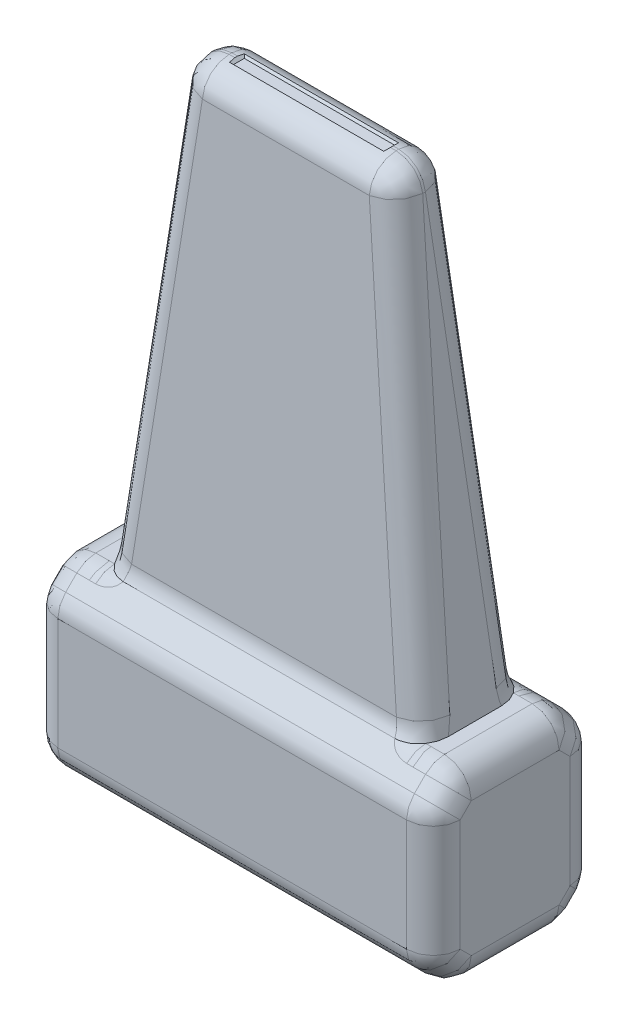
SolidWorks part; units mm, degrees
ref_plane "Спереди" through (0, 0, 0) normal (0, 0, 1) x (1, 0, 0)
ref_plane "Сверху" through (0, 0, 0) normal (0, 1, 0) x (1, 0, 0)
ref_plane "Справа" through (0, 0, 0) normal (1, 0, 0) x (0, 0, -1)
sketch "Эскиз1" plane through (0, 0, 0) normal (0, 0, 1) x (1, 0, 0)
  line L0 (0, 27.5659) -> (0, -13.9827) construction
  line L1 (-37.5, 0) -> (37.5, 0)
  line L2 (-37.5, 0) -> (-37.5, 35)
  line L3 (-37.5, 35) -> (37.5, 35)
  line L4 (37.5, 0) -> (37.5, 35)
  dimension "D1" = 35
  dimension "D2" = 75
extrude "Вытянуть1" add sketch "Эскиз1" along normal mid plane 30.5
sketch "Эскиз2" plane through (0, 0, 0) normal (0, 0, 1) x (1, 0, 0)
  line L0 (0, -8.0291) -> (0, 87.4697) construction
  line L1 (-30, 35) -> (-20, 120)
  line L2 (-20, 120) -> (20, 120)
  line L3 (20, 120) -> (30, 35)
  line L4 (30, 35) -> (-30, 35)
  line L5 (37.5, 35) -> (-37.5, 35) construction
  line L6 (-37.5, 0) -> (37.5, 0) construction
  dimension "D1" = 120
  dimension "D2" = 40
extrude "Вытянуть2" add sketch "Эскиз2" along normal mid plane 10
draft "Уклон1" type of draft neutral plane draft angle 3 faces to draft 2 parameters "D1"=3
sketch "Эскиз3" plane through (0, 0, 0) normal (0, -1, 0) x (1, 0, 0)
  line L0 (48.5885, 0) -> (-48.5885, 0) construction
  line L1 (0, -20.7863) -> (0, 26.1746) construction
  line L3 (30, 5.5) -> (-30, 5.5)
  line L4 (30, 5.5) -> (30, -5.5)
  line L5 (30, -5.5) -> (-30, -5.5)
  line L6 (-30, 5.5) -> (-30, -5.5)
  dimension "D1" = 60
  dimension "D2" = 11
extrude "Вырез-Вытянуть1" cut sketch "Эскиз3" against normal blind 19
draft "Уклон2" type of draft neutral plane draft angle 1 faces to draft 4 parameters "D1"=1
chamfer "Фаска1" distance 5 angle 45 4 edges at (0, 0, 15.25) (0, 0, -15.25) (0, 35, 15.25) (0, 35, -15.25)
fillet "Скругление2" radius 5 6 edges at (0, 30, 15.25) (0, 30, -15.25) (0, 5, 15.25) (0, 5, -15.25) (0, 0, -10.25) (0, 0, 10.25)
fillet "Скругление3" radius 5 28 edges at (37.5, 33.2322, -12.0178) (37.5, 29.8423, -14.8694) (37.5, 17.5, -15.25) (37.5, 5.1577, -14.8694) (37.5, 2.5, -12.75) (37.5, 0.3806, -10.0923) (37.5, 0, 0) (37.5, 0.3806, 10.0923) (37.5, 2.5, 12.75) (37.5, 5.1577, 14.8694) (37.5, 33.2322, 12.0178) (37.5, 29.8423, 14.8694) (37.5, 17.5, 15.25) (-37.5, 33.2322, 12.0178) (-37.5, 29.8423, 14.8694) (-37.5, 33.2322, -12.0178) (-37.5, 29.8423, -14.8694) (-37.5, 17.5, -15.25) (-37.5, 5.1577, -14.8694) (-37.5, 2.5, -12.75) (-37.5, 0.3806, -10.0923) (-37.5, 0, 0) (-37.5, 0.3806, 10.0923) (-37.5, 2.5, 12.75) (-37.5, 5.1577, 14.8694) (-37.5, 35, 0) (37.5, 35, 0) (-37.5, 17.5, 15.25)
fillet "Скругление4" radius 5 2 edges at (0, 35, -9.4547) (0, 35, 9.4547)
fillet "Скругление5" radius 5 8 edges at (-31.25, 35, -10.25) (-31.25, 35, 10.25) (31.25, 35, -10.25) (31.25, 35, 10.25) (-36.0355, 33.5355, -9.6434) (-36.0355, 33.5355, 9.6434) (36.0355, 33.5355, -9.6434) (36.0355, 33.5355, 9.6434)
fillet "Скругление6" radius 5 12 edges at (-29.8515, 36.2622, -9.5915) (29.8515, 36.2622, -9.5915) (29.8515, 36.2622, 9.5915) (-29.8515, 36.2622, 9.5915) (-20, 120, 0) (20, 120, 0) (0, 120, 5) (0, 120, -5) (-24.8436, 78.8294, -7.1577) (24.8436, 78.8294, -7.1577) (24.8436, 78.8294, 7.1577) (-24.8436, 78.8294, 7.1577)
fillet "Скругление7" radius 5 4 edges at (27.6545, 35, -10.25) (27.6545, 35, 10.25) (-27.6545, 35, -10.25) (-27.6545, 35, 10.25)
fillet "Скругление11" radius 2 8 edges at (-29.6684, 19, 0) (0, 19, 5.1684) (29.6684, 19, 0) (0, 19, -5.1684) (29.8342, 9.5, -5.3342) (-29.8342, 9.5, -5.3342) (-29.8342, 9.5, 5.3342) (29.8342, 9.5, 5.3342)
sketch "Эскиз4" plane through (0, 120, 0) normal (0, 1, 0) x (-1, 0, 0)
  line L0 (0, -4.1383) -> (0, 4.7977) construction
  line L1 (14.5, -1.5) -> (-14.5, -1.5)
  line L2 (14.5, -1.5) -> (14.5, 1.5)
  line L3 (14.5, 1.5) -> (-14.5, 1.5)
  line L4 (-14.5, -1.5) -> (-14.5, 1.5)
  line L5 (6.9696, 0) -> (-9.0984, 0) construction
  dimension "D1" = 3
  dimension "D2" = 29
extrude "Вырез-Вытянуть2" cut sketch "Эскиз4" against normal blind 0.5 draft 45
